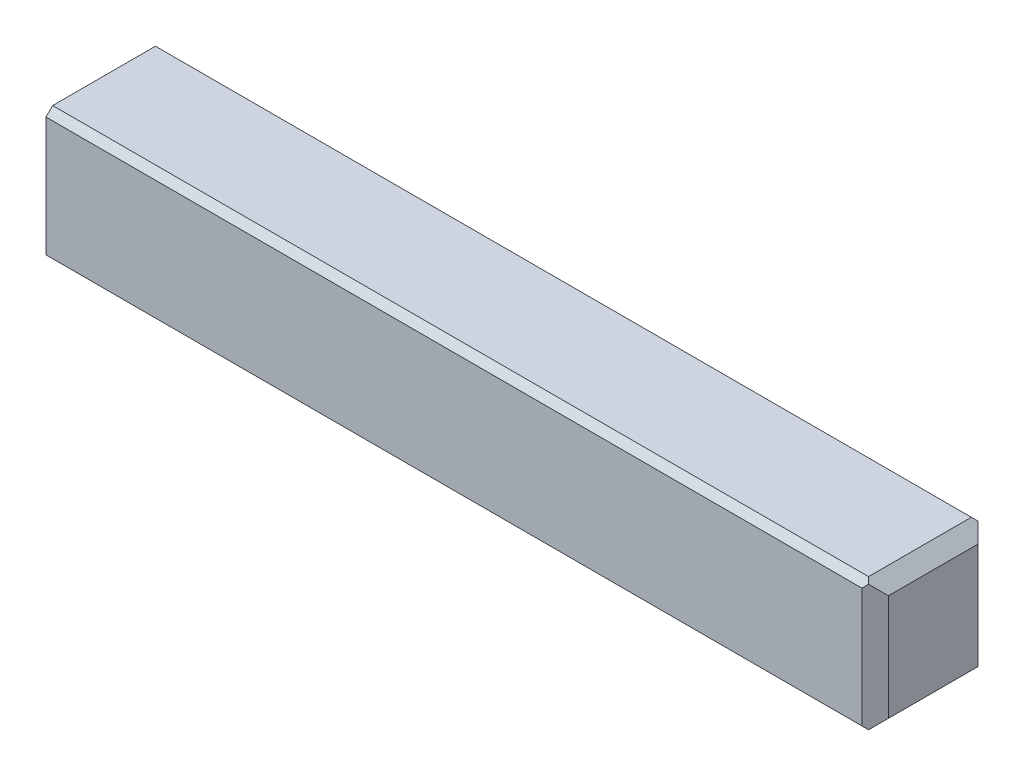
SolidWorks part; units mm, degrees
ref_plane "Front Plane" through (0, 0, 0) normal (0, 0, 1) x (1, 0, 0)
ref_plane "Top Plane" through (0, 0, 0) normal (0, 1, 0) x (1, 0, 0)
ref_plane "Right Plane" through (0, 0, 0) normal (1, 0, 0) x (0, 0, -1)
sketch "Sketch1" plane through (0, 0, 0) normal (1, 0, 0) x (0, 0, -1)
  line L0 (3.1, 4) -> (-3.1, 4)
  line L1 (-3.1, 4) -> (-3.5, 3.6)
  line L2 (-3.5, 3.6) -> (-3.5, -3.6)
  line L3 (-3.5, -3.6) -> (-3.1, -4)
  line L4 (-3.1, -4) -> (3.1, -4)
  line L5 (3.1, -4) -> (3.5, -3.6)
  line L6 (3.5, -3.6) -> (3.5, 3.6)
  line L7 (3.5, 3.6) -> (3.1, 4)
extrude "Boss-Extrude1" add sketch "Sketch1" against normal blind 50
chamfer "Chamfer1" distance 0.8 angle 45 4 edges at (0, 0, -3.5) (0, -4, 0) (0, 0, 3.5) (0, 4, 0)
